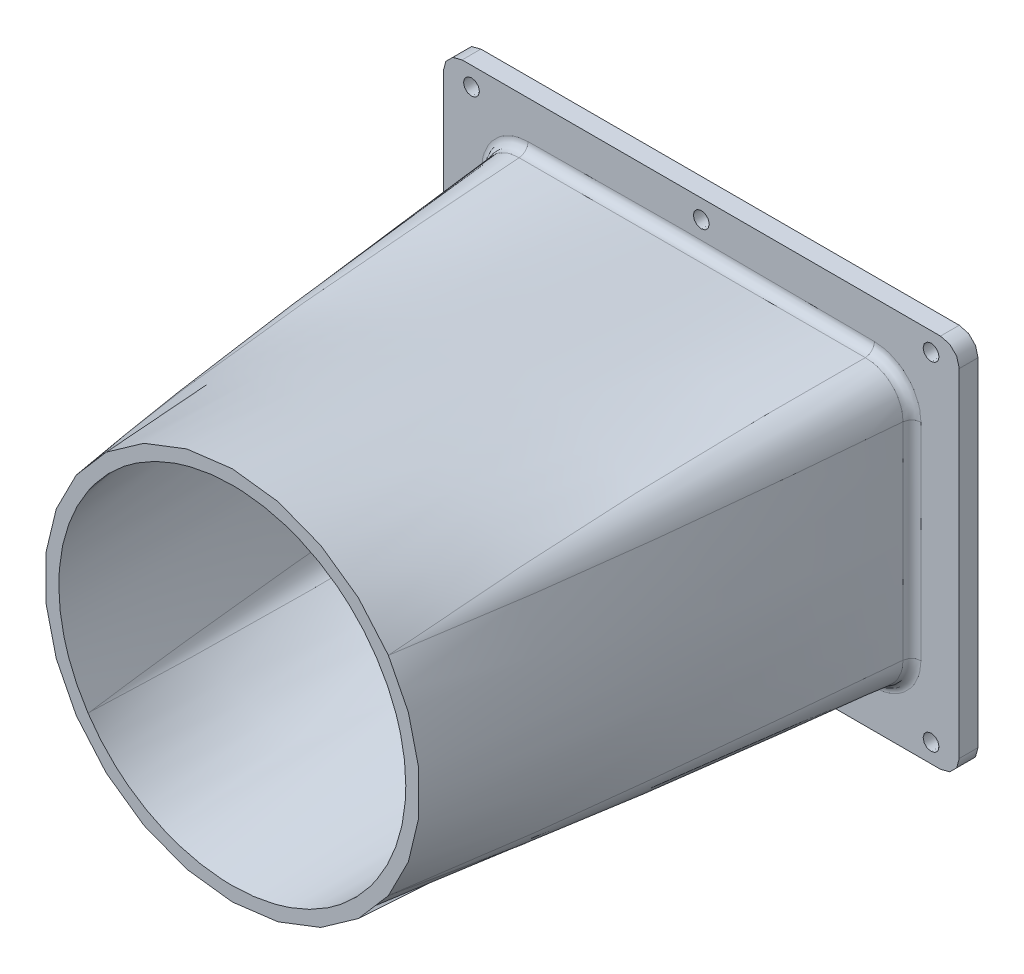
SolidWorks part; units mm, degrees
ref_plane "Plan1" through (0, 0, 0) normal (0, 0, 1) x (1, 0, 0)
ref_plane "Plan2" through (0, 0, 0) normal (0, 1, 0) x (1, 0, 0)
ref_plane "Plan3" through (0, 0, 0) normal (1, 0, 0) x (0, 0, -1)
sketch "Esquisse1" plane through (0, 0, 0) normal (0, 0, 1) x (1, 0, 0)
  line L1 (-225, 150) -> (225, 150)
  line L2 (-225, 150) -> (-225, -150)
  line L3 (-225, -150) -> (225, -150)
  line L4 (225, 150) -> (225, -150)
  dimension "D1" = 450
  dimension "D2" = 300
  dimension "D3" = 225
  dimension "D4" = 150
ref_plane "Plan4" through (0, 0, 500) normal (0, 0, 1) x (1, 0, 0)
sketch "Esquisse2" plane through (0, 0, 500) normal (0, 0, 1) x (1, 0, 0)
  circle A0 centre (0, 0) radius 200
  dimension "D1" = 400
loft "Base-Lissage" add profiles "Esquisse2", "Esquisse1"
fillet "Congé1" radius 40 4 edges at (195.705, 130.47, 250) (-195.705, 130.47, 250) (195.705, -130.47, 250) (-195.705, -130.47, 250)
shell "Coque1" thickness 15
sketch "Esquisse3" plane through (0, 0, 0) normal (0, 0, 1) x (1, 0, 0)
  line L1 (-275, 200) -> (275, 200)
  line L2 (-275, 200) -> (-275, -200)
  line L3 (-275, -200) -> (275, -200)
  line L4 (275, 200) -> (275, -200)
  dimension "D1" = 550
  dimension "D2" = 275
  dimension "D3" = 400
  dimension "D4" = 200
extrude "Boss.-Extru.1" add sketch "Esquisse3" against normal blind 20
fillet "Congé2" radius 20 4 edges at (-275, -200, -10) (-275, 200, -10) (275, 200, -10) (275, -200, -10)
sketch "Esquisse4" plane through (0, 0, -20) normal (0, 0, -1) x (-1, 0, 0)
  line L0 (0, 0) -> (0, 74.6878) construction
  line L1 (0, 0) -> (68.1045, 0) construction
  line L3 (-185, 135) -> (185, 135)
  line L4 (-210, 110) -> (-210, -110)
  line L5 (-185, -135) -> (185, -135)
  line L6 (210, 110) -> (210, -110)
  arc A0 (-210, 110) -> (-185, 135) centre (-185, 110) cw
  arc A1 (-185, -135) -> (-210, -110) centre (-185, -110) cw
  arc A2 (210, -110) -> (185, -135) centre (185, -110) cw
  arc A3 (185, 135) -> (210, 110) centre (185, 110) cw
  dimension "D5" = 25
  dimension "D1" = 25
  dimension "D3" = 420
  dimension "D4" = 270
extrude "Enlèv. mat.-Extru.1" cut sketch "Esquisse4" against normal blind 20
sketch "Esquisse5" plane through (0, 0, -20) normal (0, 0, -1) x (-1, 0, 0)
  line L0 (-255, 200) -> (255, 200) construction
  line L1 (-275, -180) -> (-275, 180) construction
  circle A0 centre (-245, 180) radius 8.5
  dimension "D1" = 17
  dimension "D3" = 30
  dimension "D2" = 20
extrude "Enlèv. mat.-Extru.2" cut sketch "Esquisse5" against normal up to next
fillet "Congé3" radius 10 12 edges at (0, 150, 0) (-178.7513, 143.2308, 172.4296) (-225, 0, 0) (-207.3948, -109.8655, 185.9106) (225, 0, 0) (0, -150, 0) (-210.053, -141.1977, 0) (216.27, -134.9762, 0) (210.053, 141.1977, 0) (-216.27, 134.9762, 0) (207.3948, 109.8655, 185.9106) (178.7513, -143.2308, 172.4296)
pattern_linear "Répétition linéaire1" count 3 spacing 245 along (-1, 0, 0) count 2 spacing 360 along (0, -1, 0) of "Enlèv. mat.-Extru.2"
